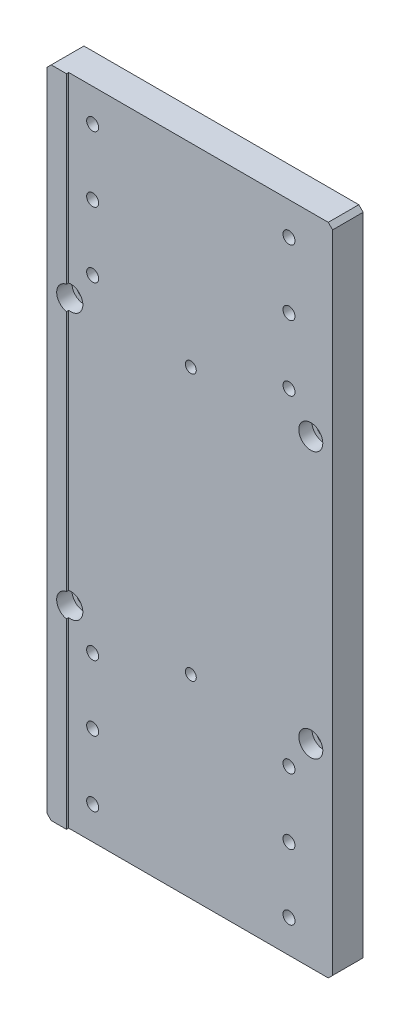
SolidWorks part; units mm, degrees
ref_plane "정면" through (0, 0, 0) normal (0, 0, 1) x (1, 0, 0)
ref_plane "윗면" through (0, 0, 0) normal (0, 1, 0) x (1, 0, 0)
ref_plane "우측면" through (0, 0, 0) normal (1, 0, 0) x (0, 0, -1)
sketch "스케치1" plane through (0, 0, 0) normal (0, 0, 1) x (1, 0, 0)
  line L5 (-65, 150) -> (65, 150)
  line L6 (-65, 150) -> (-65, -150)
  line L7 (-65, -150) -> (65, -150)
  line L8 (65, 150) -> (65, -150)
  line L9 (-65, 150) -> (65, -150) construction
  line L10 (-65, -150) -> (65, 150) construction
  point P4 (0, 0)
  dimension "D1" = 130
  dimension "D2" = 300
extrude "보스-돌출2" add sketch "스케치1" along normal mid plane 15
sketch "스케치3" plane through (0, 0, 7.5) normal (0, 0, 1) x (1, 0, 0)
  line L0 (65, 150) -> (-65, 150) construction
  line L1 (-56, 150) -> (65, 150)
  line L2 (-56, 150) -> (-56, -150)
  line L3 (-56, -150) -> (65, -150)
  line L4 (65, 150) -> (65, -150)
  line L5 (-65, 150) -> (-65, -150) construction
  dimension "D1" = 9
extrude "컷-돌출1" cut sketch "스케치3" against normal blind 1
hole_wizard "M6 소켓 머리 캡 나사용 카운터보어1" positions "스케치4" profile "스케치5" counterbore size "M6" standard "KS"
sketch "스케치4" plane through (0, 0, 7.5) normal (0, 0, 1) x (1, 0, 0)
  line L0 (65, -150) -> (65, 150) construction
  line L1 (65, 150) -> (-56, 150) construction
  point P0 (-55, 61)
  point P2 (55, 61)
  point P4 (-55, -61)
  point P6 (55, -61)
  dimension "D1" = 110
  dimension "D2" = 10
  dimension "D3" = 122
  dimension "D4" = 89
sketch "스케치5" plane through (-55, 61, 7.5) normal (1, 0, 0) x (0, -1, 0)
  line L0 (0, 0) -> (0, 15)
  line L1 (0, 15) -> (3.3, 15)
  line L3 (3.3, 15) -> (3.3, 7)
  line L4 (3.3, 7) -> (5.5, 7)
  line L5 (5.5, 7) -> (5.5, 0)
  line L7 (5.5, 0) -> (0, 0)
  line L11 (0, -6.35) -> (0, 107.95) construction
  dimension "관통 구멍 지름" = 6.6
  dimension "관통 구멍 깊이" = 15
  dimension "카운터보어 지름" = 11
  dimension "카운터보어 깊이" = 7
hole_wizard "M5 소켓 머리 캡 나사용 카운터보어1" positions "스케치6" profile "스케치7" counterbore size "M5" standard "KS"
sketch "스케치6" plane through (0, 0, -7.5) normal (0, 0, -1) x (-1, 0, 0)
  line L0 (-65, -150) -> (-65, 150) construction
  line L1 (-65, 150) -> (65, 150) construction
  point P0 (-45, 135)
  point P2 (-45, 105)
  point P4 (45, 105)
  point P6 (45, 135)
  point P8 (-45, 75)
  point P10 (45, 75)
  dimension "D1" = 90
  dimension "D2" = 20
  dimension "D3" = 15
  dimension "D4" = 30
  dimension "D5" = 30
sketch "스케치7" plane through (45, 135, -7.5) normal (1, 0, 0) x (0, 1, 0)
  line L0 (0, 0) -> (0, 15)
  line L1 (0, 15) -> (2.75, 15)
  line L3 (2.75, 15) -> (2.75, 7)
  line L4 (2.75, 7) -> (4.75, 7)
  line L5 (4.75, 7) -> (4.75, 0)
  line L7 (4.75, 0) -> (0, 0)
  line L11 (0, -6.35) -> (0, 107.95) construction
  dimension "관통 구멍 지름" = 5.5
  dimension "관통 구멍 깊이" = 15
  dimension "카운터보어 지름" = 9.5
  dimension "카운터보어 깊이" = 7
pattern_linear "선형 패턴1" count 2 spacing 210 along (0, -1, 0) of "M5 소켓 머리 캡 나사용 카운터보어1"
hole_wizard "Ø5.0mm 맞춤핀 구멍1" positions "스케치8" profile "스케치9" hole size "Ø5.0" standard "ISO"
sketch "스케치8" plane through (0, 0, 6.5) normal (0, 0, 1) x (1, 0, 0)
  line L0 (0, 0) -> (0, 161.072) construction
  line L1 (65, 150) -> (-56, 150) construction
  point P6 (0, 61)
  point P8 (0, -61)
  dimension "D1" = 122
  dimension "D2" = 89
sketch "스케치9" plane through (0, -61, 6.5) normal (1, 0, 0) x (0, -1, 0)
  line L0 (0, 0) -> (0, 14)
  line L1 (0, 14) -> (2.5, 14)
  line L2 (2.5, 14) -> (2.5, 0)
  line L5 (2.5, 0) -> (0, 0)
  line L11 (0, -6.35) -> (0, 107.95) construction
  dimension "관통 구멍 지름" = 5
  dimension "관통 구멍 깊이" = 14
chamfer "모따기1" distance 2 angle 45 4 edges at (65, -150, -0.5) (-65, -150, 0) (65, 150, -0.5) (-65, 150, 0)
